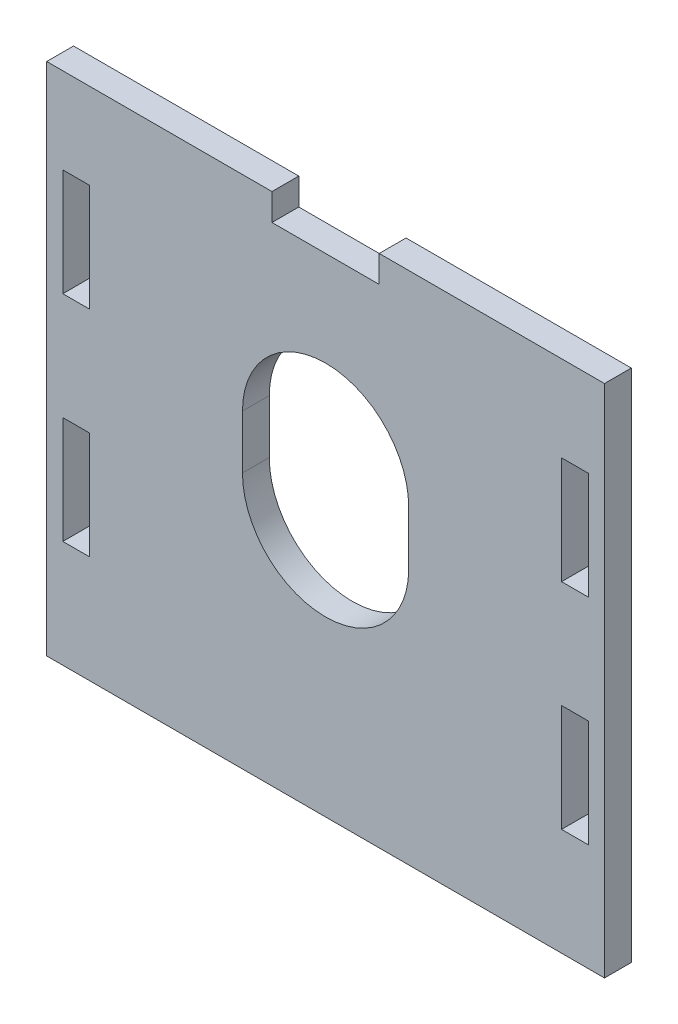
SolidWorks part; units mm, degrees
ref_plane "前视基准面" through (0, 0, 0) normal (0, 0, 1) x (1, 0, 0)
ref_plane "上视基准面" through (0, 0, 0) normal (0, 1, 0) x (1, 0, 0)
ref_plane "右视基准面" through (0, 0, 0) normal (1, 0, 0) x (0, 0, -1)
sketch "草图1" plane through (0, 0, 0) normal (0, 0, 1) x (1, 0, 0)
  line L1 (-26, 0) -> (26, 0)
  line L2 (-26, 0) -> (-26, 48)
  line L3 (-26, 48) -> (26, 48)
  line L4 (26, 0) -> (26, 48)
  dimension "D1" = 52
  dimension "D2" = 48
extrude "凸台-拉伸1" add sketch "草图1" along normal blind 2.5
sketch "草图2" plane through (0, 0, 2.5) normal (0, 0, 1) x (1, 0, 0)
  line L0 (0, 0) -> (0, 61.5244) construction
  line L1 (-26, 0) -> (26, 0) construction
  line L2 (22, 40) -> (24.5, 40)
  line L3 (22, 40) -> (22, 30)
  line L4 (22, 30) -> (24.5, 30)
  line L5 (24.5, 40) -> (24.5, 30)
  line L6 (22, 20) -> (24.5, 20)
  line L7 (22, 20) -> (22, 10)
  line L8 (22, 10) -> (24.5, 10)
  line L9 (24.5, 20) -> (24.5, 10)
  line L10 (26, 0) -> (26, 48) construction
  line L11 (-24.5, 20) -> (-24.5, 10)
  line L12 (-22, 10) -> (-24.5, 10)
  line L13 (-22, 20) -> (-22, 10)
  line L14 (-22, 20) -> (-24.5, 20)
  line L15 (-24.5, 40) -> (-24.5, 30)
  line L16 (-22, 30) -> (-24.5, 30)
  line L17 (-22, 40) -> (-22, 30)
  line L18 (-22, 40) -> (-24.5, 40)
  dimension "D1" = 10
  dimension "D2" = 10
  dimension "D3" = 10
  dimension "D4" = 2.5
  dimension "D5" = 10
  dimension "D6" = 1.5
extrude "切除-拉伸1" cut sketch "草图2" against normal up to surface (2.5 mm away)
sketch "草图3" plane through (0, 0, 2.5) normal (0, 0, 1) x (1, 0, 0)
  line L0 (0, 28.9) -> (0, 23.9) construction
  line L1 (7.75, 28.9) -> (7.75, 23.9)
  line L2 (-7.75, 28.9) -> (-7.75, 23.9)
  arc A0 (7.75, 28.9) -> (-7.75, 28.9) centre (0, 28.9) ccw
  arc A1 (-7.75, 23.9) -> (7.75, 23.9) centre (0, 23.9) ccw
  point P2 (0, 26.4)
  dimension "D2" = 5
  dimension "D1" = 15.5
extrude "切除-拉伸2" cut sketch "草图3" against normal up to surface (2.5 mm away)
sketch "草图4" plane through (0, 0, 2.5) normal (0, 0, 1) x (1, 0, 0)
  line L0 (0, 48) -> (0, 41.8413) construction
  line L1 (26, 48) -> (-26, 48) construction
  line L3 (-5, 48) -> (5, 48)
  line L4 (-5, 48) -> (-5, 45.5)
  line L5 (-5, 45.5) -> (5, 45.5)
  line L6 (5, 48) -> (5, 45.5)
  dimension "D1" = 2.5
  dimension "D2" = 10
extrude "切除-拉伸3" cut sketch "草图4" against normal up to surface (2.5 mm away)
